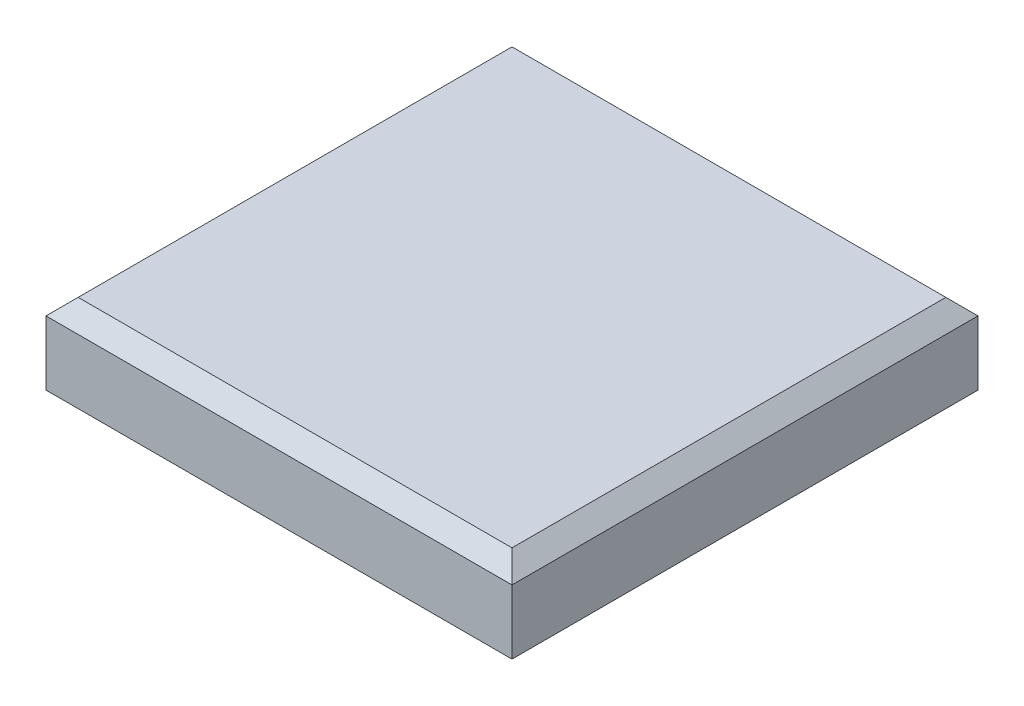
SolidWorks part; units mm, degrees
ref_plane "Front Plane" through (0, 0, 0) normal (0, 0, 1) x (1, 0, 0)
ref_plane "Top Plane" through (0, 0, 0) normal (0, 1, 0) x (1, 0, 0)
ref_plane "Right Plane" through (0, 0, 0) normal (1, 0, 0) x (0, 0, -1)
sketch "Sketch1" plane through (0, 0, 0) normal (0, 1, 0) x (1, 0, 0)
  line L1 (-145, 290) -> (145, 290)
  line L2 (-145, 290) -> (-145, 0)
  line L3 (-145, 0) -> (145, 0)
  line L4 (145, 290) -> (145, 0)
  dimension "D1" = 290
  dimension "D2" = 290
extrude "Boss-Extrude1" add sketch "Sketch1" along normal blind 50
chamfer "Chamfer1" distance 10 angle 45 4 edges at (0, 50, 0) (145, 50, -145) (0, 50, -290) (-145, 50, -145)
